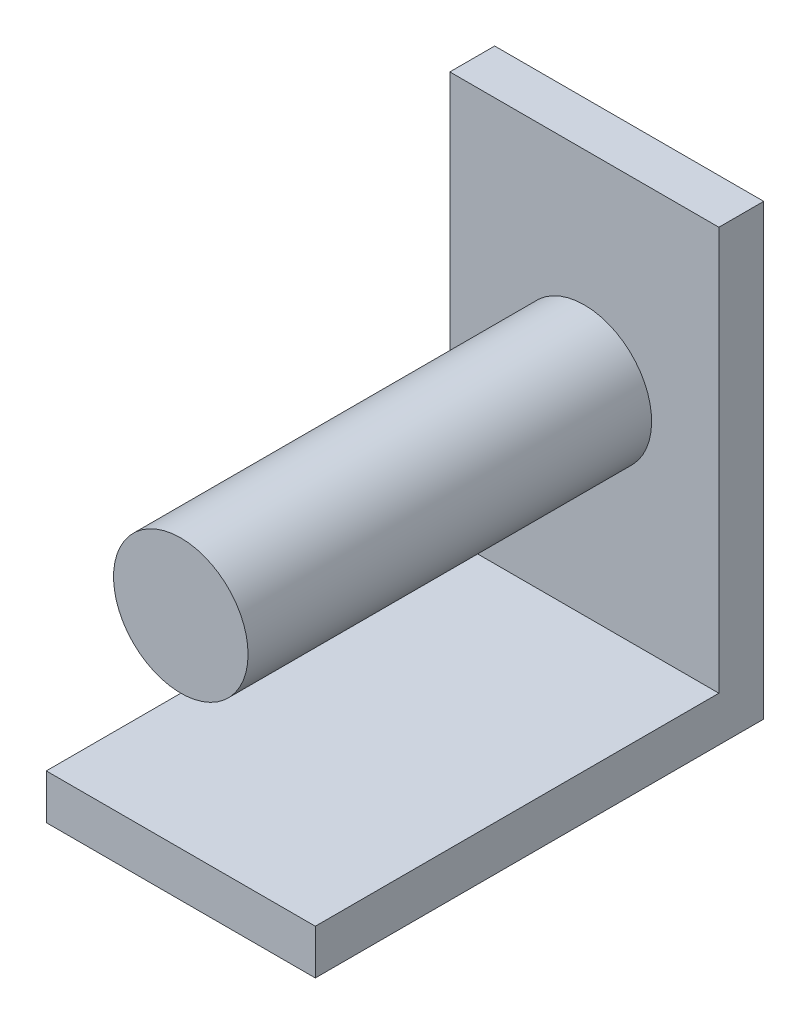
SolidWorks part; units mm, degrees
ref_plane "Front Plane" through (0, 0, 0) normal (0, 0, 1) x (1, 0, 0)
ref_plane "Top Plane" through (0, 0, 0) normal (0, 1, 0) x (1, 0, 0)
ref_plane "Right Plane" through (0, 0, 0) normal (1, 0, 0) x (0, 0, -1)
sketch "Sketch1" plane through (0, 0, 0) normal (1, 0, 0) x (0, 0, -1)
  line L0 (0, 0) -> (50, 0)
  line L1 (50, 0) -> (50, 50)
  line L2 (50, 50) -> (45, 50)
  line L3 (45, 50) -> (45, 5)
  line L4 (45, 5) -> (0, 5)
  line L5 (0, 5) -> (0, 0)
  dimension "D1" = 50
  dimension "D2" = 50
  dimension "D3" = 5
extrude "Extrude1" add sketch "Sketch1" along normal mid plane 30
sketch "Sketch2" plane through (0, 0, -45) normal (0, 0, 1) x (1, 0, 0)
  line L0 (0, 50) -> (0, 5) construction
  line L1 (15, 50) -> (-15, 50) construction
  line L2 (15, 5) -> (-15, 5) construction
  circle A0 centre (0, 27.5) radius 7.5
  dimension "D1" = 15
extrude "Extrude2" add sketch "Sketch2" along normal through all
